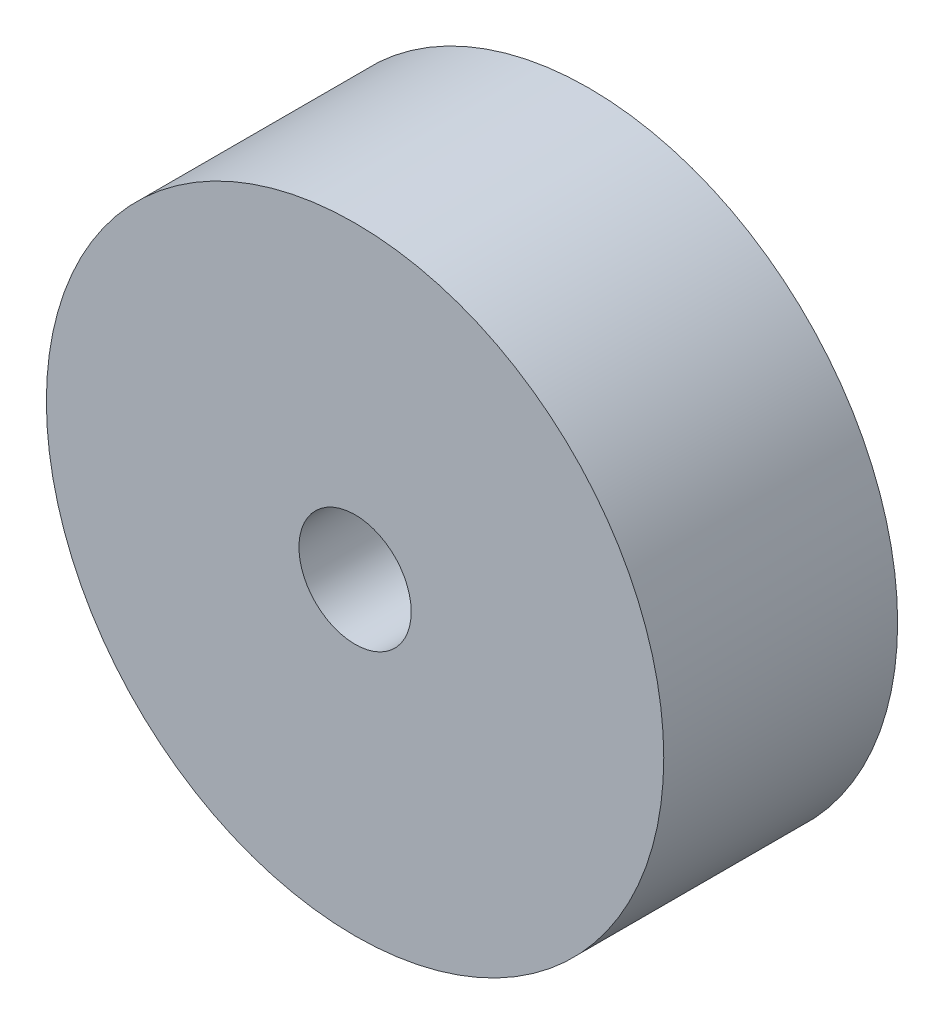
SolidWorks part; units mm, degrees
ref_plane "Front Plane" through (0, 0, 0) normal (0, 0, 1) x (1, 0, 0)
ref_plane "Top Plane" through (0, 0, 0) normal (0, 1, 0) x (1, 0, 0)
ref_plane "Right Plane" through (0, 0, 0) normal (1, 0, 0) x (0, 0, -1)
sketch "Sketch1" plane through (0, 0, 0) normal (0, 0, 1) x (1, 0, 0)
  circle A0 centre (0, 0) radius 33
  circle A1 centre (0, 0) radius 6
  dimension "D1" = 12
  dimension "D2" = 66
extrude "Boss-Extrude1" add sketch "Sketch1" against normal blind 25
